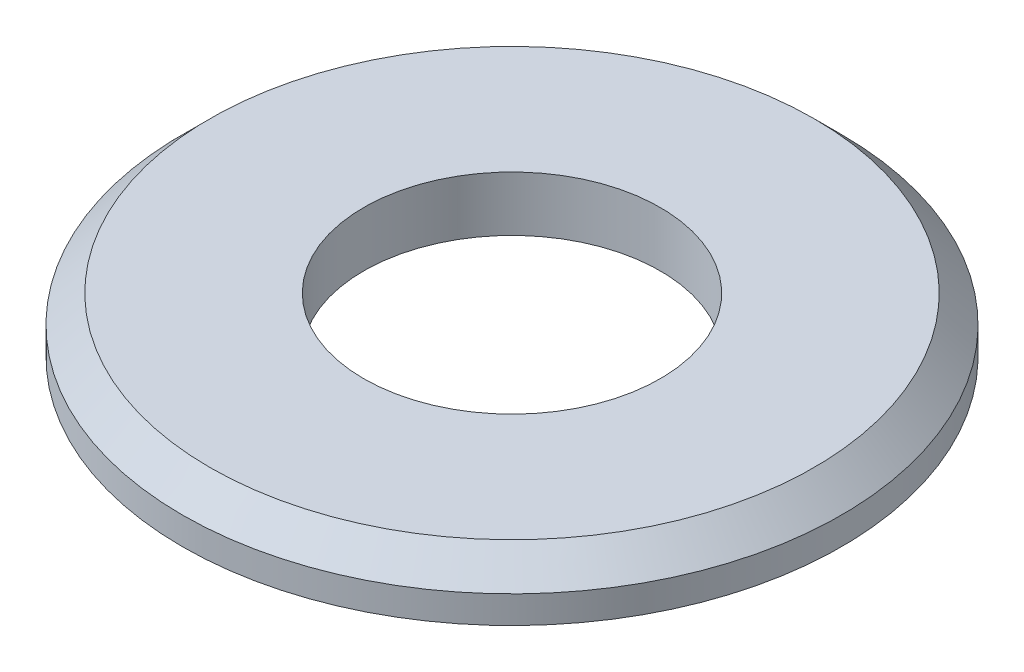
SolidWorks part; units mm, degrees
ref_plane "Front" through (0, 0, 0) normal (0, 0, 1) x (1, 0, 0)
ref_plane "Top" through (0, 0, 0) normal (0, 1, 0) x (1, 0, 0)
ref_plane "Right" through (0, 0, 0) normal (1, 0, 0) x (0, 0, -1)
sketch "Sketch1" plane through (0, 0, 0) normal (0, 1, 0) x (1, 0, 0)
  circle A0 centre (0, 0) radius 1.35
  circle A1 centre (0, 0) radius 3
extrude "Extrude1" add sketch "Sketch1" along normal blind 0.5
chamfer "Chamfer1" distance 0.25 1 edges at (0, 0.5, 3)
